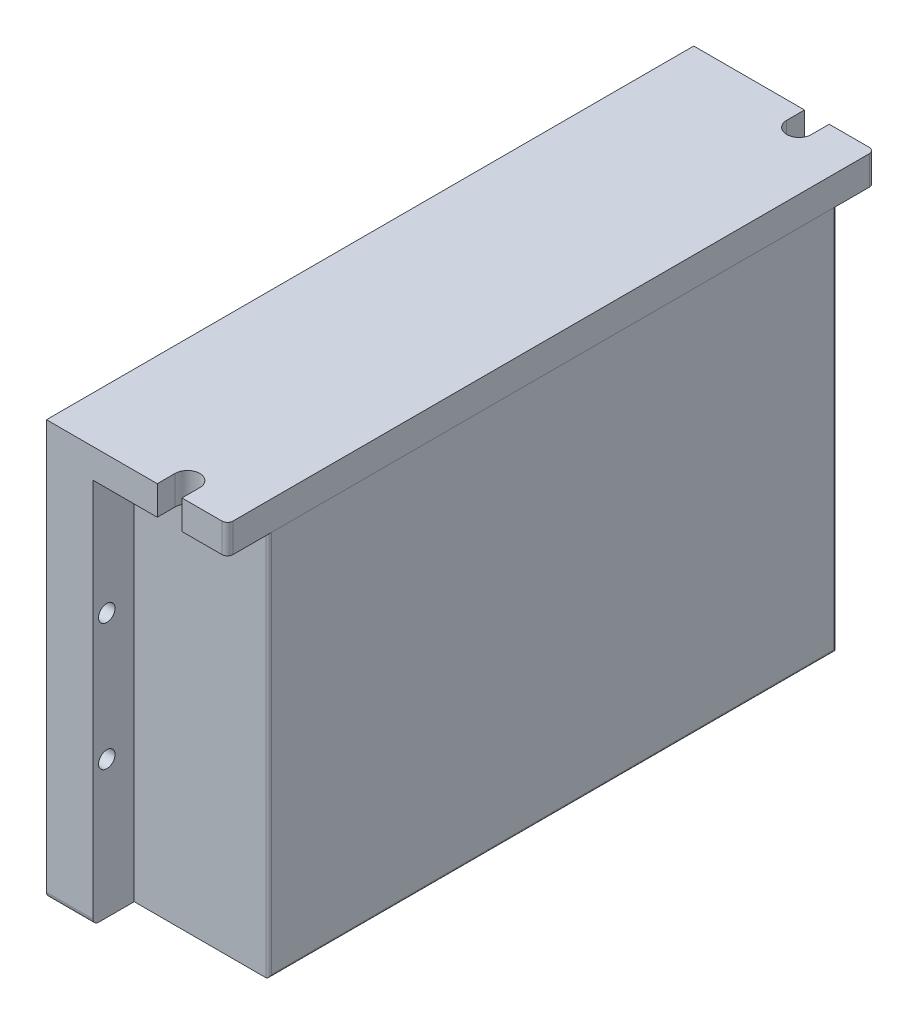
SolidWorks part; units mm, degrees
ref_plane "前视基准面" through (0, 0, 0) normal (0, 0, 1) x (1, 0, 0)
ref_plane "上视基准面" through (0, 0, 0) normal (0, 1, 0) x (1, 0, 0)
ref_plane "右视基准面" through (0, 0, 0) normal (1, 0, 0) x (0, 0, -1)
sketch "草图1" plane through (0, 0, 0) normal (1, 0, 0) x (0, 0, -1)
  line L1 (-59, -37.8) -> (59, -37.8)
  line L2 (-59, -37.8) -> (-59, 37.8)
  line L3 (-59, 37.8) -> (59, 37.8)
  line L4 (59, -37.8) -> (59, 37.8)
  line L5 (-59, -37.8) -> (59, 37.8) construction
  line L6 (-59, 37.8) -> (59, -37.8) construction
  point P0 (0, 0)
extrude "凸台-拉伸1" add sketch "草图1" along normal blind 8.5
sketch "草图2" plane through (8.5, 0, 0) normal (1, 0, 0) x (0, 0, -1)
  line L0 (-59, 37.8) -> (-59, 32.5)
  line L1 (-59, 37.8) -> (-59, -37.8) construction
  line L2 (-59, 32.5) -> (59, 32.5)
  line L3 (59, -37.8) -> (59, 37.8) construction
  line L4 (59, 32.5) -> (59, 37.8)
  line L5 (59, 37.8) -> (-59, 37.8)
extrude "凸台-拉伸2" add sketch "草图2" along normal blind 24.5
sketch "草图3" plane through (8.5, 0, 0) normal (1, 0, 0) x (0, 0, -1)
  line L1 (-59, 32.5) -> (59, 32.5) construction
  line L3 (-59, 32.5) -> (59, 32.5) construction
  line L4 (-51.5, 32.5) -> (-51.5, -37.8)
  line L5 (-59, -37.8) -> (59, -37.8) construction
  line L6 (-51.5, -37.8) -> (52, -37.8)
  line L7 (52, -37.8) -> (52, 32.5)
  line L8 (-51.5, 32.5) -> (52, 32.5)
extrude "凸台-拉伸3" add sketch "草图3" along normal blind 24.5 separate body
sketch "草图4" plane through (0, 37.8, 0) normal (0, 1, 0) x (1, 0, 0)
  line L3 (20.2, 55.75) -> (20.2, 59)
  line L4 (20.2, 59) -> (24.7, 59)
  line L5 (24.7, 59) -> (24.7, 55.75)
  line L6 (20.2, -55.75) -> (20.2, -59)
  line L7 (33, -59) -> (0, -59) construction
  line L9 (20.2, -59) -> (24.7, -59)
  line L10 (24.7, -59) -> (24.7, -55.75)
  arc A0 (20.2, 55.75) -> (24.7, 55.75) centre (22.45, 55.75) ccw
  arc A1 (24.7, -55.75) -> (20.2, -55.75) centre (22.45, -55.75) ccw
extrude "切除-拉伸1" cut sketch "草图4" against normal blind 5.3
fillet "圆角1" radius 0.5 3 edges at (33, -2.65, -52) (33, -2.65, 51.5) (33, -37.8, -0.25)
fillet "圆角2" radius 1 4 edges at (33, 35.15, -59) (33, 35.15, 59) (4.25, -37.8, 59) (4.25, -37.8, -59)
sketch "草图5" plane through (8.5, 0, 0) normal (1, 0, 0) x (0, 0, -1)
  circle A0 centre (-56.5, -12.8) radius 1.5
  circle A1 centre (56.5, -12.8) radius 1.5
  circle A2 centre (-56.5, 10.3) radius 1.5
  circle A3 centre (56.5, 10.3) radius 1.5
extrude "切除-拉伸2" cut sketch "草图5" against normal blind 8.5
sketch "草图6" plane through (33, 0, 0) normal (1, 0, 0) x (0, 0, -1)
  text T0 "MD-4  " font "汉仪长仿宋体" height 8
